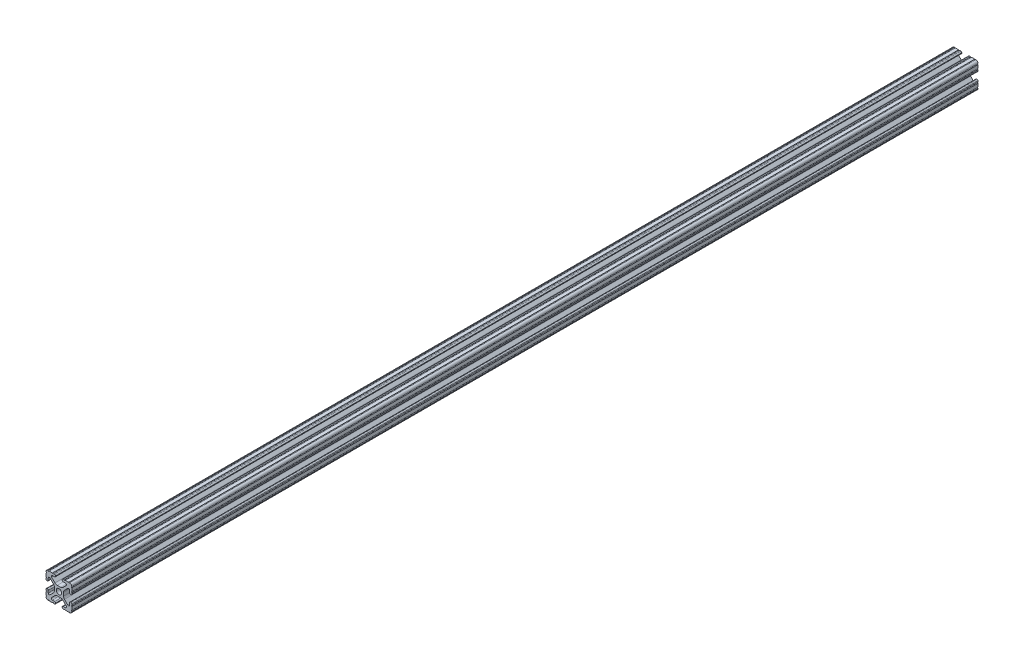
SolidWorks part; units mm, degrees
ref_plane "Front" through (0, 0, 0) normal (0, 0, 1) x (1, 0, 0)
ref_plane "Top" through (0, 0, 0) normal (0, 1, 0) x (1, 0, 0)
ref_plane "Right" through (0, 0, 0) normal (1, 0, 0) x (0, 0, -1)
sketch "Sketch1" plane through (0, 0, 0) normal (0, 0, 1) x (1, 0, 0)
  line L0 (-7.5107, 9.4563) -> (7.5107, 9.4563) construction
  line L1 (-7.4968, -9.4098) -> (7.4968, -9.4098) construction
  line L88 (-7.1797, -8.6452) -> (-3.9523, -5.4237)
  line L89 (-1.7093, -4.4958) -> (1.7093, -4.4958)
  line L90 (3.9523, -5.4237) -> (7.1797, -8.6452)
  line L91 (6.4164, -10.4902) -> (4.2875, -10.4902)
  line L92 (3.2385, -11.5392) -> (3.2385, -11.651)
  line L93 (4.2875, -12.7) -> (5.3171, -12.7)
  line L94 (6.3331, -12.7) -> (9.5504, -12.7)
  line L95 (12.7, -9.5504) -> (12.7, -6.3331)
  line L96 (12.7, -5.3171) -> (12.7, -4.2875)
  line L97 (11.651, -3.2385) -> (11.5392, -3.2385)
  line L98 (10.4902, -4.2875) -> (10.4902, -6.4021)
  line L99 (8.7371, -7.1294) -> (5.441, -3.8408)
  line L100 (4.5085, -1.5932) -> (4.5085, 1.5932)
  line L101 (5.441, 3.8408) -> (8.7371, 7.1294)
  line L102 (10.4902, 6.4021) -> (10.4902, 4.2875)
  line L103 (11.5392, 3.2385) -> (11.651, 3.2385)
  line L104 (12.7, 4.2875) -> (12.7, 5.3171)
  line L105 (12.7, 6.3331) -> (12.7, 9.5504)
  line L106 (9.5504, 12.7) -> (6.3331, 12.7)
  line L107 (5.3171, 12.7) -> (4.2875, 12.7)
  line L108 (3.2385, 11.651) -> (3.2385, 11.5392)
  line L109 (4.2875, 10.4902) -> (6.4768, 10.4902)
  line L110 (7.207, 8.7244) -> (3.8983, 5.4232)
  line L111 (1.6558, 4.4958) -> (-1.6558, 4.4958)
  line L112 (-3.8983, 5.4232) -> (-7.207, 8.7244)
  line L113 (-6.4768, 10.4902) -> (-4.2875, 10.4902)
  line L114 (-3.2385, 11.5392) -> (-3.2385, 11.651)
  line L115 (-4.2875, 12.7) -> (-5.3171, 12.7)
  line L116 (-6.3331, 12.7) -> (-9.5504, 12.7)
  line L117 (-12.7, 9.5504) -> (-12.7, 6.3331)
  line L118 (-12.7, 5.3171) -> (-12.7, 4.2875)
  line L119 (-11.651, 3.2385) -> (-11.5392, 3.2385)
  line L120 (-10.4902, 4.2875) -> (-10.4902, 6.4021)
  line L121 (-8.7371, 7.1294) -> (-5.441, 3.8408)
  line L122 (-4.5085, 1.5932) -> (-4.5085, -1.5932)
  line L123 (-5.441, -3.8408) -> (-8.7371, -7.1294)
  line L124 (-10.4902, -6.4021) -> (-10.4902, -4.2875)
  line L125 (-11.5392, -3.2385) -> (-11.651, -3.2385)
  line L126 (-12.7, -4.2875) -> (-12.7, -5.3171)
  line L127 (-12.7, -6.3331) -> (-12.7, -9.5504)
  line L128 (-9.5504, -12.7) -> (-6.3331, -12.7)
  line L129 (-5.3171, -12.7) -> (-4.2875, -12.7)
  line L130 (-3.2385, -11.651) -> (-3.2385, -11.5392)
  line L131 (-4.2875, -10.4902) -> (-6.4164, -10.4902)
  circle A1 centre (0, 0) radius 2.6035
  arc A104 (-7.1797, -8.6452) -> (-6.4164, -10.4902) centre (-6.4164, -9.4098) ccw
  arc A105 (-1.7093, -4.4958) -> (-3.9523, -5.4237) centre (-1.7093, -7.6708) ccw
  arc A106 (3.9523, -5.4237) -> (1.7093, -4.4958) centre (1.7093, -7.6708) ccw
  arc A107 (6.4164, -10.4902) -> (7.1797, -8.6452) centre (6.4164, -9.4098) ccw
  arc A108 (4.2875, -10.4902) -> (3.2385, -11.5392) centre (4.2875, -11.5392) ccw
  arc A109 (3.2385, -11.651) -> (4.2875, -12.7) centre (4.2875, -11.651) ccw
  arc A110 (6.3331, -12.7) -> (5.3171, -12.7) centre (5.8251, -12.7) ccw
  arc A111 (10.5664, -12.6998) -> (9.5504, -12.7) centre (10.0584, -12.7) ccw
  arc A112 (10.5664, -12.6998) -> (12.6998, -10.5664) centre (10.5918, -10.5918) ccw
  arc A113 (12.7, -9.5504) -> (12.6998, -10.5664) centre (12.7, -10.0584) ccw
  arc A114 (12.7, -5.3171) -> (12.7, -6.3331) centre (12.7, -5.8251) ccw
  arc A115 (12.7, -4.2875) -> (11.651, -3.2385) centre (11.651, -4.2875) ccw
  arc A116 (11.5392, -3.2385) -> (10.4902, -4.2875) centre (11.5392, -4.2875) ccw
  arc A117 (8.7371, -7.1294) -> (10.4902, -6.4021) centre (9.4628, -6.4021) ccw
  arc A118 (4.5085, -1.5932) -> (5.441, -3.8408) centre (7.6835, -1.5932) ccw
  arc A119 (5.441, 3.8408) -> (4.5085, 1.5932) centre (7.6835, 1.5932) ccw
  arc A120 (10.4902, 6.4021) -> (8.7371, 7.1294) centre (9.4628, 6.4021) ccw
  arc A121 (10.4902, 4.2875) -> (11.5392, 3.2385) centre (11.5392, 4.2875) ccw
  arc A122 (11.651, 3.2385) -> (12.7, 4.2875) centre (11.651, 4.2875) ccw
  arc A123 (12.7, 6.3331) -> (12.7, 5.3171) centre (12.7, 5.8251) ccw
  arc A124 (12.6998, 10.5664) -> (12.7, 9.5504) centre (12.7, 10.0584) ccw
  arc A125 (12.6998, 10.5664) -> (10.5664, 12.6998) centre (10.5918, 10.5918) ccw
  arc A126 (9.5504, 12.7) -> (10.5664, 12.6998) centre (10.0584, 12.7) ccw
  arc A127 (5.3171, 12.7) -> (6.3331, 12.7) centre (5.8251, 12.7) ccw
  arc A128 (4.2875, 12.7) -> (3.2385, 11.651) centre (4.2875, 11.651) ccw
  arc A129 (3.2385, 11.5392) -> (4.2875, 10.4902) centre (4.2875, 11.5392) ccw
  arc A130 (7.207, 8.7244) -> (6.4768, 10.4902) centre (6.4768, 9.4563) ccw
  arc A131 (1.6558, 4.4958) -> (3.8983, 5.4232) centre (1.6558, 7.6708) ccw
  arc A132 (-3.8983, 5.4232) -> (-1.6558, 4.4958) centre (-1.6558, 7.6708) ccw
  arc A133 (-6.4768, 10.4902) -> (-7.207, 8.7244) centre (-6.4768, 9.4563) ccw
  arc A134 (-4.2875, 10.4902) -> (-3.2385, 11.5392) centre (-4.2875, 11.5392) ccw
  arc A135 (-3.2385, 11.651) -> (-4.2875, 12.7) centre (-4.2875, 11.651) ccw
  arc A136 (-6.3331, 12.7) -> (-5.3171, 12.7) centre (-5.8251, 12.7) ccw
  arc A137 (-10.5664, 12.6998) -> (-9.5504, 12.7) centre (-10.0584, 12.7) ccw
  arc A138 (-10.5664, 12.6998) -> (-12.6998, 10.5664) centre (-10.5918, 10.5918) ccw
  arc A139 (-12.7, 9.5504) -> (-12.6998, 10.5664) centre (-12.7, 10.0584) ccw
  arc A140 (-12.7, 5.3171) -> (-12.7, 6.3331) centre (-12.7, 5.8251) ccw
  arc A141 (-12.7, 4.2875) -> (-11.651, 3.2385) centre (-11.651, 4.2875) ccw
  arc A142 (-11.5392, 3.2385) -> (-10.4902, 4.2875) centre (-11.5392, 4.2875) ccw
  arc A143 (-8.7371, 7.1294) -> (-10.4902, 6.4021) centre (-9.4628, 6.4021) ccw
  arc A144 (-4.5085, 1.5932) -> (-5.441, 3.8408) centre (-7.6835, 1.5932) ccw
  arc A145 (-5.441, -3.8408) -> (-4.5085, -1.5932) centre (-7.6835, -1.5932) ccw
  arc A146 (-10.4902, -6.4021) -> (-8.7371, -7.1294) centre (-9.4628, -6.4021) ccw
  arc A147 (-10.4902, -4.2875) -> (-11.5392, -3.2385) centre (-11.5392, -4.2875) ccw
  arc A148 (-11.651, -3.2385) -> (-12.7, -4.2875) centre (-11.651, -4.2875) ccw
  arc A149 (-12.7, -6.3331) -> (-12.7, -5.3171) centre (-12.7, -5.8251) ccw
  arc A150 (-12.6998, -10.5664) -> (-12.7, -9.5504) centre (-12.7, -10.0584) ccw
  arc A151 (-12.6998, -10.5664) -> (-10.5664, -12.6998) centre (-10.5918, -10.5918) ccw
  arc A152 (-9.5504, -12.7) -> (-10.5664, -12.6998) centre (-10.0584, -12.7) ccw
  arc A153 (-5.3171, -12.7) -> (-6.3331, -12.7) centre (-5.8251, -12.7) ccw
  arc A154 (-4.2875, -12.7) -> (-3.2385, -11.651) centre (-4.2875, -11.651) ccw
  arc A155 (-3.2385, -11.5392) -> (-4.2875, -10.4902) centre (-4.2875, -11.5392) ccw
extrude "Boss-Extrude1" add sketch "Sketch1" along normal up to surface (891.1082 mm away)
